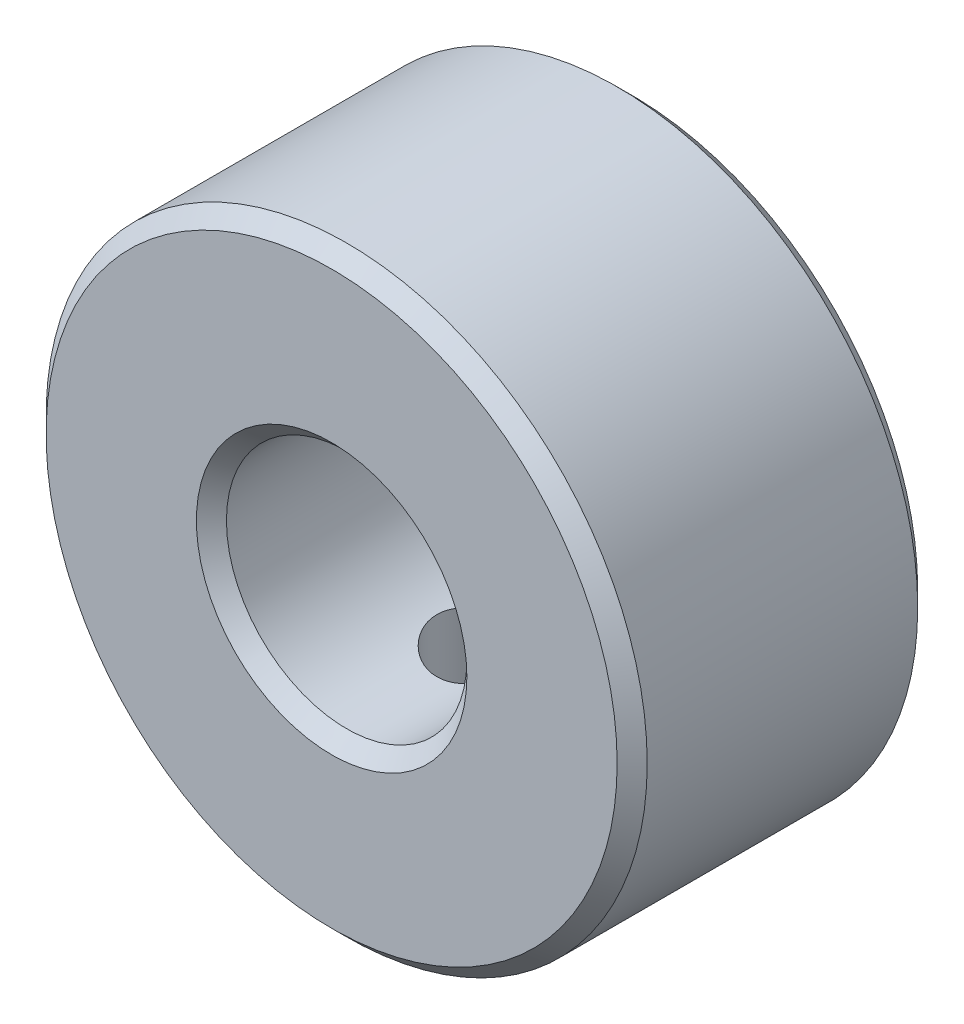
SolidWorks part; units mm, degrees
ref_plane "Front" through (0, 0, 0) normal (0, 0, 1) x (1, 0, 0)
ref_plane "Top" through (0, 0, 0) normal (0, 1, 0) x (1, 0, 0)
ref_plane "Right" through (0, 0, 0) normal (1, 0, 0) x (0, 0, -1)
sketch "Sketch1" plane through (0, 0, 0) normal (0, 0, 1) x (1, 0, 0)
  circle A0 centre (0, 0) radius 10
  circle A1 centre (0, 0) radius 4
  dimension "d" = 8
  dimension "D0" = 20
extrude "Base-Extrude" add sketch "Sketch1" against normal blind 10
chamfer "Chamfer1" distance 0.5 angle 45 2 edges at (10, 0, -10) (10, 0, 0)
sketch "Sketch2" plane through (0, 0, 0) normal (0, 1, 0) x (1, 0, 0)
  line L1 (0, 3.5505) -> (0, -10.3547) construction
  line L3 (9.5, 10) -> (-9.5, 10) construction
  circle A0 centre (0, 5) radius 1.5
  dimension "d1" = 3
  dimension "H/2" = 5
extrude "Hole" cut sketch "Sketch2" against normal through all
chamfer "Chamfer2" distance 0.5 angle 45 2 edges at (4, 0, 0) (4, 0, -10)
equation "\"H/2@Sketch2\" = \"H@Base-Extrude\" / 2"
